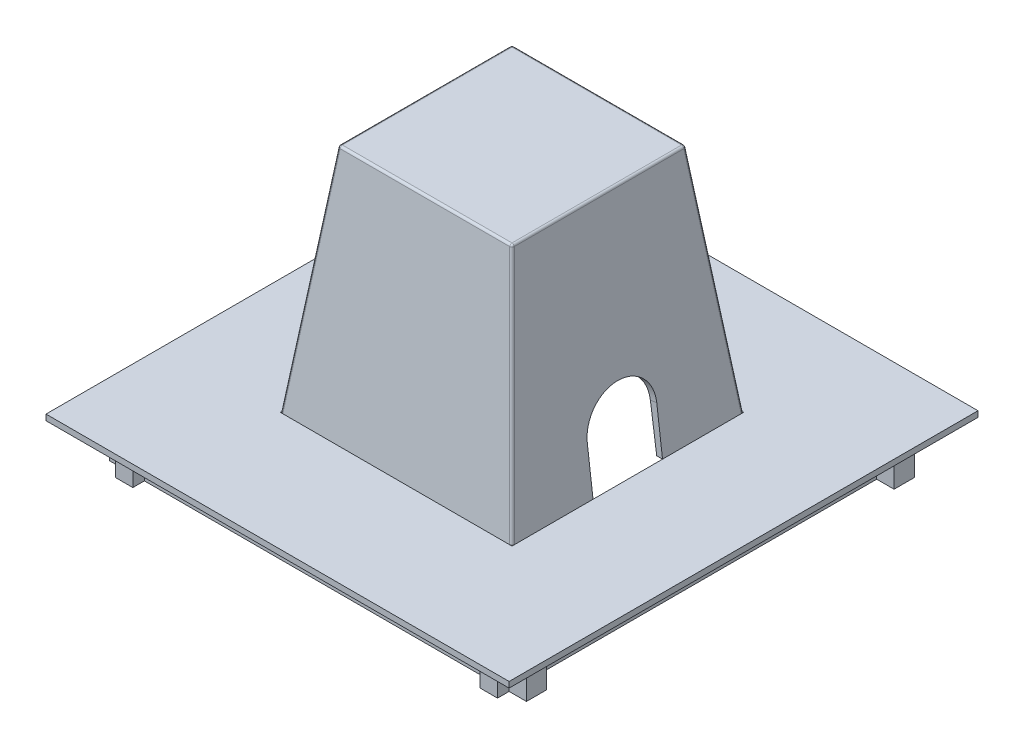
SolidWorks part; units mm, degrees
ref_plane "Front Plane" through (0, 0, 0) normal (0, 0, 1) x (1, 0, 0)
ref_plane "Top Plane" through (0, 0, 0) normal (0, 1, 0) x (1, 0, 0)
ref_plane "Right Plane" through (0, 0, 0) normal (1, 0, 0) x (0, 0, -1)
sketch "Sketch1" plane through (0, 0, 0) normal (0, 1, 0) x (1, 0, 0)
  line L1 (0, -914.4) -> (-38.1, -914.4)
  line L3 (-38.1, 0) -> (0, 0)
  line L4 (-38.1, -82.55) -> (-800.1, -82.55)
  line L5 (-38.1, -844.55) -> (-800.1, -844.55)
  line L6 (0, -38.1) -> (38.1, -38.1)
  line L7 (-800.1, -889) -> (-38.1, -889)
  line L8 (38.1, -38.1) -> (38.1, -82.55)
  line L9 (-800.1, -38.1) -> (-38.1, -38.1)
  line L10 (-800.1, -82.55) -> (-800.1, -844.55)
  line L11 (-800.1, -889) -> (-800.1, -914.4)
  line L12 (-800.1, -914.4) -> (-838.2, -914.4)
  line L14 (-838.2, 0) -> (-800.1, 0)
  line L15 (-800.1, 0) -> (-800.1, -38.1)
  line L16 (-38.1, -889) -> (-38.1, -914.4)
  line L17 (-38.1, -844.55) -> (-38.1, -82.55)
  line L18 (-38.1, -38.1) -> (-38.1, 0)
  line L19 (38.1, -82.55) -> (0, -82.55)
  line L20 (0, -844.55) -> (38.1, -844.55)
  line L21 (38.1, -844.55) -> (38.1, -889)
  line L22 (38.1, -889) -> (0, -889)
  line L23 (-838.2, -38.1) -> (-876.3, -38.1)
  line L24 (-876.3, -38.1) -> (-876.3, -82.55)
  line L25 (-876.3, -82.55) -> (-838.2, -82.55)
  line L26 (-838.2, -889) -> (-876.3, -889)
  line L27 (-876.3, -889) -> (-876.3, -844.55)
  line L28 (-876.3, -844.55) -> (-838.2, -844.55)
  line L29 (-838.2, -914.4) -> (-838.2, -889)
  line L30 (-838.2, -844.55) -> (-838.2, -82.55)
  line L31 (-838.2, 0) -> (-838.2, -38.1)
  line L32 (0, -914.4) -> (0, -889)
  line L33 (0, -844.55) -> (0, -82.55)
  line L34 (0, 0) -> (0, -38.1)
  dimension "D1" = 914.4
  dimension "D2" = 38.1
  dimension "D3" = 762
  dimension "D4" = 38.1
  dimension "D5" = 82.55
  dimension "D6" = 44.45
  dimension "D7" = 44.45
  dimension "D8" = 762
  dimension "D9" = 38.1
  dimension "D10" = 914.4
  dimension "D11" = 914.4
  dimension "D12" = 914.4
  dimension "D13" = 38.1
extrude "Boss-Extrude1" add sketch "Sketch1" along normal blind 95.25
sketch "Sketch2" plane through (0, 95.25, 0) normal (0, 1, 0) x (1, 0, 0)
  line L0 (0, 0) -> (-38.1, 0) construction
  line L1 (38.1, -82.55) -> (38.1, -38.1) construction
  line L9 (-927.1, -977.9) -> (88.9, -977.9)
  line L10 (-927.1, -977.9) -> (-927.1, 50.8)
  line L11 (-927.1, 50.8) -> (88.9, 50.8)
  line L12 (88.9, -977.9) -> (88.9, 50.8)
  line L13 (-927.1, -977.9) -> (88.9, 50.8) construction
  line L14 (-927.1, 50.8) -> (88.9, -977.9) construction
  line L16 (-38.1, -844.55) -> (-38.1, -82.55) construction
  line L17 (-673.1, -717.55) -> (-165.1, -717.55)
  line L18 (-673.1, -717.55) -> (-673.1, -209.55)
  line L19 (-673.1, -209.55) -> (-165.1, -209.55)
  line L20 (-165.1, -717.55) -> (-165.1, -209.55)
  line L21 (-673.1, -717.55) -> (-165.1, -209.55) construction
  line L22 (-673.1, -209.55) -> (-165.1, -717.55) construction
  line L23 (-38.1, -844.55) -> (-800.1, -844.55) construction
  point P0 (-419.1, -463.55)
  point P4 (-419.1, -463.55)
  dimension "D1" = 508
  dimension "D2" = 508
  dimension "D3" = 50.8
  dimension "D4" = 50.8
  dimension "D5" = 381
  dimension "D6" = 381
extrude "Boss-Extrude2" add sketch "Sketch2" along normal blind 12.7
sketch3d "3DSketch2"
  line L0 (88.9, 107.95, -50.8) -> (88.9, 615.95, -50.8) construction
  line L1 (-927.1, 107.95, 977.9) -> (-927.1, 615.95, 977.9) construction
  line L2 (-673.1, 107.95, 209.55) -> (-673.1, 107.95, 717.55) construction
  line L3 (-165.1, 107.95, 209.55) -> (-673.1, 107.95, 209.55) construction
  line L4 (-165.1, 107.95, 717.55) -> (-165.1, 107.95, 209.55) construction
  line L5 (-673.1, 107.95, 717.55) -> (-165.1, 107.95, 717.55) construction
  line L6 (-673.1, 107.95, 209.55) -> (-673.1, 107.95, 717.55)
  line L7 (-165.1, 107.95, 209.55) -> (-673.1, 107.95, 209.55)
  line L8 (-165.1, 107.95, 717.55) -> (-165.1, 107.95, 209.55)
  line L9 (-673.1, 107.95, 717.55) -> (-165.1, 107.95, 717.55)
  line L11 (-673.1, 107.95, 209.55) -> (-165.1, 107.95, 717.55)
  line L12 (-673.1, 107.95, 717.55) -> (-165.1, 107.95, 209.55)
  line L13 (-419.1, 107.95, 463.55) -> (-419.1, 280.1256, 463.55) construction
  point P13 (-419.1, 107.95, 463.55)
  dimension "D1" = 508
sketch "Sketch4" plane through (0, 107.95, 0) normal (0, 1, 0) x (1, 0, 0)
  line L8 (-673.1, -717.55) -> (-165.1, -717.55) construction
  line L9 (-673.1, -209.55) -> (-673.1, -717.55) construction
  line L10 (-165.1, -209.55) -> (-673.1, -209.55) construction
  line L11 (-165.1, -717.55) -> (-165.1, -209.55) construction
  line L12 (-673.1, -717.55) -> (-165.1, -717.55)
  line L13 (-673.1, -209.55) -> (-673.1, -717.55)
  line L14 (-165.1, -209.55) -> (-673.1, -209.55)
  line L15 (-165.1, -717.55) -> (-165.1, -209.55)
sketch "Sketch7" plane through (0, 615.95, 0) normal (0, -1, 0) x (-1, 0, 0)
  line L1 (228.6, -654.05) -> (609.6, -654.05)
  line L2 (228.6, -654.05) -> (228.6, -273.05)
  line L3 (228.6, -273.05) -> (609.6, -273.05)
  line L4 (609.6, -654.05) -> (609.6, -273.05)
  line L5 (228.6, -654.05) -> (609.6, -273.05) construction
  line L6 (228.6, -273.05) -> (609.6, -654.05) construction
  point P0 (419.1, -463.55)
  dimension "D1" = 381
  dimension "D2" = 381
loft "Loft1" add profiles "Sketch4", "Sketch7"
fillet "Fillet1" radius 5.08 8 edges
sketch "Sketch8" plane through (-149.2738, -18.6592, 0) normal (0.9923, 0.124, 0) x (0, 0, -1)
  line L0 (-539.75, 127.5945) -> (-387.35, 127.5945)
  line L1 (-717.55, 127.5945) -> (-209.55, 127.5945) construction
  line L2 (-387.35, 127.5945) -> (-387.35, 229.1945)
  line L3 (-463.55, 127.5945) -> (-463.55, 305.3945) construction
  line L4 (-539.75, 127.5945) -> (-539.75, 229.1945)
  arc A0 (-387.35, 229.1945) -> (-539.75, 229.1945) centre (-463.55, 229.1945) ccw
  dimension "D1" = 76.2
  dimension "D2" = 101.6
sketch "Sketch10" plane through (0, 107.95, 0) normal (0, -1, 0) x (1, 0, 0)
  line L0 (-673.1, 717.55) -> (-165.1, 717.55) construction
  line L1 (-177.8, 222.25) -> (-660.4, 222.25)
  line L2 (-177.8, 222.25) -> (-177.8, 704.85)
  line L3 (-177.8, 704.85) -> (-660.4, 704.85)
  line L4 (-660.4, 222.25) -> (-660.4, 704.85)
  line L5 (-177.8, 222.25) -> (-660.4, 704.85) construction
  line L6 (-177.8, 704.85) -> (-660.4, 222.25) construction
  line L7 (-165.1, 717.55) -> (-165.1, 209.55) construction
  line L8 (-165.1, 209.55) -> (-673.1, 209.55) construction
  line L9 (-673.1, 209.55) -> (-673.1, 717.55) construction
  point P0 (-419.1, 463.55)
  dimension "D1" = 12.7
  dimension "D2" = 12.7
  dimension "D3" = 12.7
  dimension "D4" = 12.7
extrude "Cut-Extrude2" cut sketch "Sketch10" against normal blind 462.28 draft 8
extrude "Cut-Extrude3" cut sketch "Sketch8" against normal blind 375.92 contours A0 L4 L0 L2
